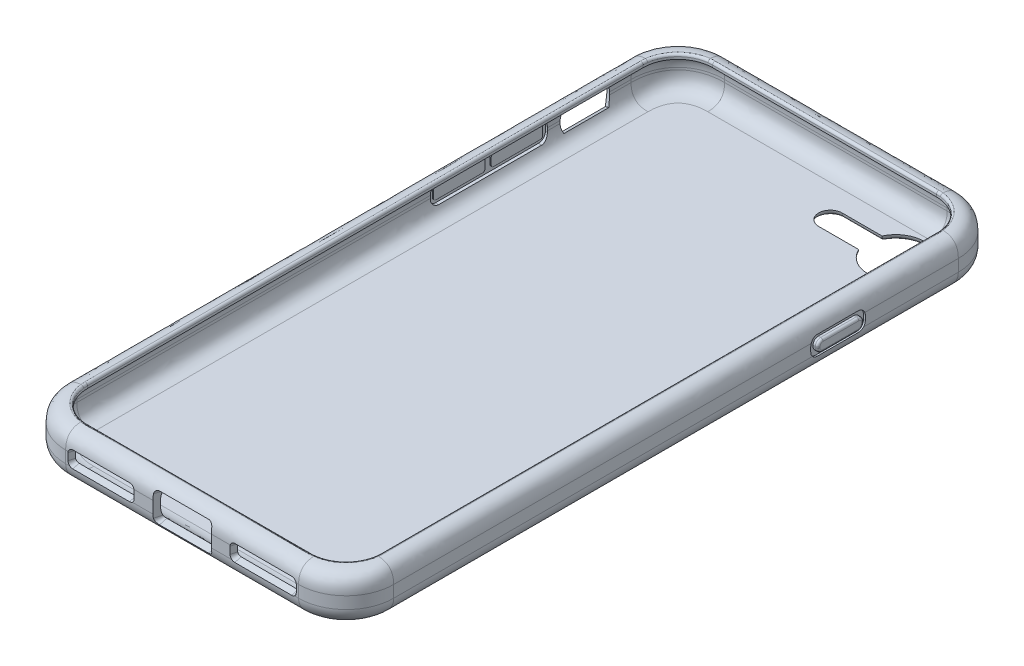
SolidWorks part; units mm, degrees
ref_plane "Front Plane" through (0, 0, 0) normal (0, 0, 1) x (1, 0, 0)
ref_plane "Top Plane" through (0, 0, 0) normal (0, 1, 0) x (1, 0, 0)
ref_plane "Right Plane" through (0, 0, 0) normal (1, 0, 0) x (0, 0, -1)
sketch "Sketch1" plane through (0, 0, 0) normal (0, 1, 0) x (1, 0, 0)
  line L1 (-35.052, 70.5) -> (35.052, 70.5)
  line L2 (-35.052, 70.5) -> (-35.052, -70.5)
  line L3 (-35.052, -70.5) -> (35.052, -70.5)
  line L4 (35.052, 70.5) -> (35.052, -70.5)
  line L5 (-35.052, 70.5) -> (35.052, -70.5) construction
  line L6 (-35.052, -70.5) -> (35.052, 70.5) construction
  point P0 (0, 0)
  dimension "D1" = 70.104
  dimension "D2" = 141
extrude "Back Plane" add sketch "Sketch1" along normal blind 1.27
sketch "Sketch2" plane through (0, 1.27, 0) normal (0, 1, 0) x (1, 0, 0)
  line L0 (-35.052, -70.5) -> (0, -70.5)
  line L1 (-35.052, -70.5) -> (35.052, -70.5) construction
  line L2 (-35.052, 70.5) -> (-35.052, -70.5)
  line L3 (-35.052, 70.5) -> (35.052, 70.5)
  line L4 (-33.782, 69.23) -> (-33.782, -69.23)
  line L5 (0, -70.5) -> (35.052, -70.5)
  line L6 (-33.782, -69.23) -> (33.782, -69.23)
  line L7 (35.052, 70.5) -> (35.052, -70.5)
  line L9 (33.782, 69.23) -> (33.782, -69.23)
  line L12 (-33.782, 69.23) -> (33.782, 69.23)
  dimension "D1" = 1.27
  dimension "D2" = 1.27
  dimension "D3" = 1.27
  dimension "D5" = 1.27
extrude "Sides" add sketch "Sketch2" along normal blind 7.5
sketch "Sketch7" plane through (0, 0, 0) normal (0, -1, 0) x (1, 0, 0)
  line L0 (35.052, 70.5) -> (35.052, -70.5) construction
  line L2 (17.8476, -61.25) -> (9.302, -61.25)
  line L3 (17.8476, -56.25) -> (9.302, -56.25)
  line L6 (35.052, -70.5) -> (-35.052, -70.5) construction
  arc A0 (17.8476, -61.25) -> (17.8476, -56.25) centre (23.302, -58.75) ccw
  arc A2 (9.302, -56.25) -> (9.302, -61.25) centre (9.302, -58.75) ccw
  point P8 (23.302, -58.75)
  dimension "D7" = 12
  dimension "D5" = 2.5
  dimension "D1" = 14
  dimension "D3" = 11.75
  dimension "D4" = 11.75
extrude "Camera Hole" cut sketch "Sketch7" against normal blind 1.27
fillet "Inside Corner Fillet" radius 10 4 edges at (33.782, 5.02, -69.23) (-33.782, 5.02, -69.23) (-33.782, 5.02, 69.23) (33.782, 5.02, 69.23)
fillet "Outside Corner Fillet" radius 10.16 4 edges at (-35.052, 4.385, -70.5) (35.052, 4.385, -70.5) (35.052, 4.385, 70.5) (-35.052, 4.385, 70.5)
fillet "Inside Bottom Fillet" radius 3.6 8 edges
fillet "Outside Bottom Fillet" radius 3.62 8 edges at (-32.0762, 0, 67.5242) (-35.052, 0, 0) (-32.0762, 0, -67.5242) (0, 0, -70.5) (32.0762, 0, -67.5242) (35.052, 0, 0) (32.0762, 0, 67.5242) (0, 0, 70.5)
fillet "Camera Hole FIllet" radius 1.27 4 edges at (29.302, 0, -58.75) (13.5748, 0, -56.25) (6.802, 0, -58.75) (13.5748, 0, -61.25)
sketch "Sketch16" plane through (-35.052, 0, 0) normal (-1, 0, 0) x (0, 0, 1)
  line L0 (-60.34, 8.77) -> (-60.34, 3.62) construction
  line L1 (-54.84, 8.0237) -> (-43.84, 8.0237)
  line L2 (-60.34, 3.62) -> (-60.34, 0) construction
  line L3 (-54.84, 2.0237) -> (-43.84, 2.0237)
  line L6 (-60.34, 3.62) -> (60.34, 3.62) construction
  spline S0 degree 2 poles (-54.84, 8.0237) (-55.867, 5.0522) (-54.84, 2.0237) knots 0 0 0 1 1 1
  spline S1 degree 2 poles (-43.84, 8.0237) (-42.813, 5.0522) (-43.84, 2.0237) knots 0 0 0 1 1 1
  dimension "D1" = 2.5
  dimension "D2" = 6
  dimension "D3" = 1.5963
  dimension "D4" = 1.5963
  dimension "D5" = 2.5
  dimension "D6" = 11
  dimension "D7" = 0.5
  dimension "D8" = 0.5
  dimension "D9" = 5.5
  dimension "D10" = 5.5
  dimension "D11" = 11
extrude "Mute Slider Hole" cut sketch "Sketch16" against normal up to next draft 30
sketch "Sketch18" plane through (-35.052, 0, 0) normal (-1, 0, 0) x (0, 0, 1)
  line L0 (-43.4407, 3.62) -> (60.34, 3.62) construction
  line L1 (-39.8294, 7.12) -> (-17.8294, 7.12)
  line L2 (-41.3294, 5.62) -> (-41.3294, 4.62)
  line L3 (-39.8294, 3.12) -> (-17.8294, 3.12)
  line L4 (-16.3294, 5.62) -> (-16.3294, 4.62)
  arc A0 (-17.8294, 3.12) -> (-16.3294, 4.62) centre (-17.8294, 4.62) ccw
  arc A1 (-17.8294, 7.12) -> (-16.3294, 5.62) centre (-17.8294, 5.62) cw
  arc A2 (-41.3294, 4.62) -> (-39.8294, 3.12) centre (-39.8294, 4.62) ccw
  arc A3 (-39.8294, 7.12) -> (-41.3294, 5.62) centre (-39.8294, 5.62) ccw
  point P12 (-41.3294, 3.12)
  point P15 (-41.3294, 7.12)
  dimension "D3" = 1.5
  dimension "D1" = 4
  dimension "D2" = 0.5
  dimension "D4" = 25
extrude "Volume Rocker Indent" cut sketch "Sketch18" against normal blind 0.4 contours L1 A1 L4 A0 L3 A2 L2 A3
sketch "Sketch19" plane through (-34.652, 0, 0) normal (-1, 0, 0) x (0, 0, 1)
  line L0 (-39.8294, 3.12) -> (-17.8294, 3.12) construction
  line L1 (-39.371, 6.37) -> (-30.621, 6.37)
  line L2 (-40.496, 5.245) -> (-40.496, 4.995)
  line L3 (-39.371, 3.87) -> (-30.621, 3.87)
  line L4 (-29.496, 5.245) -> (-29.496, 4.995)
  line L5 (-27.0377, 6.37) -> (-18.2877, 6.37)
  line L6 (-28.1627, 5.245) -> (-28.1627, 4.995)
  line L7 (-27.0377, 3.87) -> (-18.2877, 3.87)
  line L8 (-17.1627, 5.245) -> (-17.1627, 4.995)
  line L9 (-41.3294, 5.62) -> (-41.3294, 4.62) construction
  arc A0 (-18.2877, 6.37) -> (-17.1627, 5.245) centre (-18.2877, 5.245) cw
  arc A1 (-18.2877, 3.87) -> (-17.1627, 4.995) centre (-18.2877, 4.995) ccw
  arc A2 (-28.1627, 4.995) -> (-27.0377, 3.87) centre (-27.0377, 4.995) ccw
  arc A3 (-27.0377, 6.37) -> (-28.1627, 5.245) centre (-27.0377, 5.245) ccw
  arc A4 (-30.621, 3.87) -> (-29.496, 4.995) centre (-30.621, 4.995) ccw
  arc A5 (-30.621, 6.37) -> (-29.496, 5.245) centre (-30.621, 5.245) cw
  arc A6 (-39.371, 6.37) -> (-40.496, 5.245) centre (-39.371, 5.245) ccw
  arc A7 (-40.496, 4.995) -> (-39.371, 3.87) centre (-39.371, 4.995) ccw
  dimension "D10" = 1.125
  dimension "D1" = 2.5
  dimension "D2" = 0.75
  dimension "D3" = 11
  dimension "D4" = 2.5
  dimension "D5" = 11
  dimension "D6" = 0.75
  dimension "D7" = 0.8333
  dimension "D8" = 0.8333
extrude "Volume Rockers" add sketch "Sketch19" along normal blind 0.9
fillet "Volume Rocker Fillet" radius 0.5 16 edges at (-35.552, 3.87, -34.996) (-35.552, 4.1995, -40.1665) (-35.552, 5.12, -40.496) (-35.552, 6.0405, -40.1665) (-35.552, 6.37, -34.996) (-35.552, 6.0405, -29.8255) (-35.552, 5.12, -29.496) (-35.552, 4.1995, -29.8255) (-35.552, 5.12, -17.1627) (-35.552, 4.1995, -17.4922) (-35.552, 3.87, -22.6627) (-35.552, 4.1995, -27.8332) (-35.552, 5.12, -28.1627) (-35.552, 6.0405, -27.8332) (-35.552, 6.37, -22.6627) (-35.552, 6.0405, -17.4922)
sketch "Sketch20" plane through (35.052, 0, 0) normal (1, 0, 0) x (0, 0, -1)
  line L0 (-60.34, 3.62) -> (60.34, 3.62) construction
  line L1 (38.9591, 7.12) -> (30.2991, 7.12)
  line L2 (40.4591, 5.62) -> (40.4591, 4.62)
  line L3 (38.9591, 3.12) -> (30.2991, 3.12)
  line L4 (28.7991, 5.62) -> (28.7991, 4.62)
  arc A4 (30.2991, 3.12) -> (28.7991, 4.62) centre (30.2991, 4.62) cw
  arc A5 (40.4591, 4.62) -> (38.9591, 3.12) centre (38.9591, 4.62) cw
  arc A6 (38.9591, 7.12) -> (40.4591, 5.62) centre (38.9591, 5.62) cw
  arc A7 (30.2991, 7.12) -> (28.7991, 5.62) centre (30.2991, 5.62) ccw
  point P26 (40.4591, 3.12)
  point P29 (40.4591, 7.12)
  dimension "D5" = 1.5
  dimension "D1" = 0.5
  dimension "D2" = 4
  dimension "D4" = 11.66
extrude "Power Button Indent" cut sketch "Sketch20" against normal blind 0.4
sketch "Sketch23" plane through (34.652, 0, 0) normal (1, 0, 0) x (0, 0, -1)
  line L0 (30.2991, 3.12) -> (38.9591, 3.12) construction
  line L1 (29.6891, 6.37) -> (39.5691, 6.37)
  line L2 (29.6891, 6.37) -> (29.6891, 3.87)
  line L3 (29.6891, 3.87) -> (39.5691, 3.87)
  line L4 (39.5691, 6.37) -> (39.5691, 3.87)
  line L8 (40.4591, 4.62) -> (40.4591, 5.62) construction
  line L9 (28.7991, 5.62) -> (28.7991, 4.62) construction
  point P11 (40.4591, 5.12)
  dimension "D1" = 0.75
  dimension "D3" = 2.5
  dimension "D4" = 0.89
  dimension "D5" = 0.89
extrude "Power Button" add sketch "Sketch23" along normal blind 1 contours L1 L4 L3 L2
fillet "Power Button FIllet 1" radius 1.13 4 edges at (35.152, 6.37, -29.6891) (35.152, 3.87, -29.6891) (35.152, 3.87, -39.5691) (35.152, 6.37, -39.5691)
fillet "Power Button Fillet 2" radius 0.5 8 edges at (35.652, 6.039, -39.2382) (35.652, 5.12, -39.5691) (35.652, 4.201, -39.2382) (35.652, 3.87, -34.6291) (35.652, 4.201, -30.0201) (35.652, 5.12, -29.6891) (35.652, 6.039, -30.0201) (35.652, 6.37, -34.6291)
sketch "Sketch29" plane through (33.782, 0, 0) normal (-1, 0, 0) x (0, 0, 1)
  line L1 (-30.2991, 7.12) -> (-38.9591, 7.12)
  line L2 (-28.7991, 5.62) -> (-28.7991, 4.62)
  line L3 (-30.2991, 3.12) -> (-38.9591, 3.12)
  line L4 (-40.4591, 5.62) -> (-40.4591, 4.62)
  line L5 (-40.4591, 4.62) -> (-40.4591, 5.62) construction
  line L6 (-30.2991, 3.12) -> (-38.9591, 3.12) construction
  arc A4 (-38.9591, 3.12) -> (-40.4591, 4.62) centre (-38.9591, 4.62) cw
  arc A5 (-28.7991, 4.62) -> (-30.2991, 3.12) centre (-30.2991, 4.62) cw
  arc A6 (-30.2991, 7.12) -> (-28.7991, 5.62) centre (-30.2991, 5.62) cw
  arc A7 (-38.9591, 7.12) -> (-40.4591, 5.62) centre (-38.9591, 5.62) ccw
  point P26 (-28.7991, 3.12)
  point P29 (-28.7991, 7.12)
  dimension "D5" = 1.5
  dimension "D1" = 0
  dimension "D2" = 4
  dimension "D3" = 0
  dimension "D4" = 11.66
extrude "Power Button Indent (Inside)" cut sketch "Sketch29" against normal blind 0.4 contours L1 A7 L4 A4 L3 A5 L2 A6
sketch "Sketch32" plane through (34.182, 0, 0) normal (-1, 0, 0) x (0, 0, 1)
  line L0 (-40.4591, 5.62) -> (-40.4591, 4.87) construction
  line L1 (-30.2991, 7.12) -> (-38.9591, 7.12)
  line L2 (-28.7991, 5.62) -> (-28.7991, 4.62)
  line L3 (-30.2991, 3.12) -> (-38.9591, 3.12)
  line L4 (-40.4591, 5.62) -> (-40.4591, 4.62)
  line L7 (-30.2991, 7.12) -> (-38.9591, 7.12) construction
  arc A4 (-38.9591, 3.12) -> (-40.4591, 4.62) centre (-38.9591, 4.62) cw
  arc A5 (-28.7991, 4.62) -> (-30.2991, 3.12) centre (-30.2991, 4.62) cw
  arc A6 (-30.2991, 7.12) -> (-28.7991, 5.62) centre (-30.2991, 5.62) cw
  arc A7 (-38.9591, 7.12) -> (-40.4591, 5.62) centre (-38.9591, 5.62) ccw
  point P26 (-28.7991, 3.12)
  point P29 (-28.7991, 7.12)
  dimension "D5" = 1.5
  dimension "D1" = 0
  dimension "D2" = 4
  dimension "D3" = 0
  dimension "D4" = 11.66
extrude "Power Button Indent (Inside) 2" cut sketch "Sketch32" along normal blind 5 contours L4 A4 L3 A5 L2 A6 L1 A7
sketch "Sketch35" plane through (34.182, 0, 0) normal (-1, 0, 0) x (0, 0, 1)
  line L1 (-38.4391, 6.37) -> (-30.8191, 6.37)
  line L2 (-39.5691, 5.24) -> (-39.5691, 5)
  line L3 (-38.4391, 3.87) -> (-30.8191, 3.87)
  line L4 (-29.6891, 5.24) -> (-29.6891, 5)
  line L5 (-40.4591, 5.62) -> (-40.4591, 4.62) construction
  line L6 (-28.7991, 5.62) -> (-28.7991, 4.62) construction
  line L10 (-30.2991, 3.12) -> (-38.9591, 3.12) construction
  line L11 (-30.2991, 7.12) -> (-38.9591, 7.12) construction
  arc A0 (-30.8191, 3.87) -> (-29.6891, 5) centre (-30.8191, 5) ccw
  arc A1 (-30.8191, 6.37) -> (-29.6891, 5.24) centre (-30.8191, 5.24) cw
  arc A2 (-39.5691, 5) -> (-38.4391, 3.87) centre (-38.4391, 5) ccw
  arc A3 (-38.4391, 6.37) -> (-39.5691, 5.24) centre (-38.4391, 5.24) ccw
  dimension "D6" = 1.13
  dimension "D1" = 0.89
  dimension "D2" = 0.89
  dimension "D3" = 2.5
  dimension "D4" = 0.75
  dimension "D5" = 0.75
extrude "Power Button Nub (Inside)" add sketch "Sketch35" along normal blind 0.25
sketch "Sketch36" plane through (-33.782, 0, 0) normal (1, 0, 0) x (0, 0, -1)
  line L1 (17.8294, 7.12) -> (39.8294, 7.12)
  line L2 (16.3294, 5.62) -> (16.3294, 4.62)
  line L3 (17.8294, 3.12) -> (39.8294, 3.12)
  line L4 (41.3294, 5.62) -> (41.3294, 4.62)
  line L5 (12.3294, 6.8267) -> (11.0942, 3.9367) construction
  line L6 (16.3294, 5.62) -> (16.3294, 4.62) construction
  line L7 (39.8294, 3.12) -> (17.8294, 3.12) construction
  arc A0 (39.8294, 3.12) -> (41.3294, 4.62) centre (39.8294, 4.62) ccw
  arc A1 (39.8294, 7.12) -> (41.3294, 5.62) centre (39.8294, 5.62) cw
  arc A2 (16.3294, 4.62) -> (17.8294, 3.12) centre (17.8294, 4.62) ccw
  arc A3 (17.8294, 7.12) -> (16.3294, 5.62) centre (17.8294, 5.62) ccw
  point P4 (16.3294, 5.12)
  point P12 (16.3294, 3.12)
  point P15 (16.3294, 7.12)
  point P20 (11.0942, 3.9367)
  point P21 (12.3294, 6.8267)
  dimension "D3" = 1.5
  dimension "D5" = 0
  dimension "D1" = 4
  dimension "D2" = 0
  dimension "D4" = 25
  dimension "D6" = 4
extrude "Volume Rocker Indent (Inside)" cut sketch "Sketch36" against normal blind 0.4
sketch "Sketch37" plane through (-34.182, 0, 0) normal (1, 0, 0) x (0, 0, -1)
  line L1 (17.8294, 7.12) -> (39.8294, 7.12)
  line L2 (16.3294, 5.62) -> (16.3294, 4.62)
  line L3 (17.8294, 3.12) -> (39.8294, 3.12)
  line L4 (41.3294, 5.62) -> (41.3294, 4.62)
  line L5 (12.3294, 6.6598) -> (11.0942, 3.7698) construction
  line L6 (16.3294, 5.62) -> (16.3294, 4.87) construction
  line L7 (39.8294, 7.12) -> (17.8294, 7.12) construction
  arc A0 (39.8294, 3.12) -> (41.3294, 4.62) centre (39.8294, 4.62) ccw
  arc A1 (39.8294, 7.12) -> (41.3294, 5.62) centre (39.8294, 5.62) cw
  arc A2 (16.3294, 4.62) -> (17.8294, 3.12) centre (17.8294, 4.62) ccw
  arc A3 (17.8294, 7.12) -> (16.3294, 5.62) centre (17.8294, 5.62) ccw
  point P12 (16.3294, 3.12)
  point P15 (16.3294, 7.12)
  point P20 (11.0942, 3.7698)
  point P21 (12.3294, 6.6598)
  dimension "D3" = 1.5
  dimension "D5" = 0
  dimension "D1" = 4
  dimension "D2" = 0
  dimension "D4" = 25
  dimension "D6" = 4
extrude "Volume Rocker Indent (Inside) 2" cut sketch "Sketch37" along normal blind 5
sketch "Sketch42" plane through (-34.182, 0, 0) normal (1, 0, 0) x (0, 0, -1)
  line L1 (27.6627, 6.37) -> (17.6627, 6.37)
  line L2 (28.1627, 5.87) -> (28.1627, 4.37)
  line L3 (27.6627, 3.87) -> (17.6627, 3.87)
  line L4 (17.1627, 5.87) -> (17.1627, 4.37)
  line L5 (29.996, 6.37) -> (39.996, 6.37)
  line L6 (29.496, 5.87) -> (29.496, 4.37)
  line L7 (29.996, 3.87) -> (39.996, 3.87)
  line L8 (40.496, 5.87) -> (40.496, 4.37)
  arc A0 (39.996, 6.37) -> (40.496, 5.87) centre (39.996, 5.87) cw
  arc A1 (39.996, 3.87) -> (40.496, 4.37) centre (39.996, 4.37) ccw
  arc A2 (29.496, 4.37) -> (29.996, 3.87) centre (29.996, 4.37) ccw
  arc A3 (29.996, 6.37) -> (29.496, 5.87) centre (29.996, 5.87) ccw
  arc A4 (17.6627, 6.37) -> (17.1627, 5.87) centre (17.6627, 5.87) ccw
  arc A5 (17.6627, 3.87) -> (17.1627, 4.37) centre (17.6627, 4.37) cw
  arc A6 (28.1627, 4.37) -> (27.6627, 3.87) centre (27.6627, 4.37) cw
  arc A7 (27.6627, 6.37) -> (28.1627, 5.87) centre (27.6627, 5.87) cw
  dimension "D9" = 0.5
  dimension "D1" = 0
  dimension "D2" = 0
  dimension "D3" = 0
  dimension "D4" = 0
  dimension "D5" = 0
  dimension "D6" = 0
  dimension "D7" = 0
  dimension "D8" = 0
extrude "Volume Rocker Nub (Inside)" add sketch "Sketch42" along normal blind 0.25
sketch "Sketch43" plane through (0, 8.77, 0) normal (0, 1, 0) x (1, 0, 0)
  line L0 (35.052, -60.34) -> (35.052, 60.34) construction
  line L1 (-24.892, 70.5) -> (24.892, 70.5)
  line L2 (-35.052, 60.34) -> (-35.052, -60.34)
  line L3 (-24.892, -70.5) -> (24.892, -70.5)
  line L4 (35.052, 60.34) -> (35.052, -60.34)
  line L5 (-24.892, -70.5) -> (24.892, -70.5) construction
  line L6 (-35.052, 60.34) -> (-35.052, -60.34) construction
  line L7 (24.892, 70.5) -> (-24.892, 70.5) construction
  line L9 (-23.922, 66.8) -> (23.922, 66.8)
  line L10 (-31.352, 59.37) -> (-31.352, -59.37)
  line L11 (-23.922, -66.8) -> (23.922, -66.8)
  line L12 (31.352, 59.37) -> (31.352, -59.37)
  arc A0 (-24.892, 70.5) -> (-35.052, 60.34) centre (-24.892, 60.34) ccw
  arc A1 (24.892, 70.5) -> (35.052, 60.34) centre (24.892, 60.34) cw
  arc A2 (24.892, -70.5) -> (35.052, -60.34) centre (24.892, -60.34) ccw
  arc A3 (-35.052, -60.34) -> (-24.892, -70.5) centre (-24.892, -60.34) ccw
  arc A4 (23.922, 66.8) -> (31.352, 59.37) centre (23.922, 59.37) cw
  arc A5 (-23.922, 66.8) -> (-31.352, 59.37) centre (-23.922, 59.37) ccw
  arc A6 (-31.352, -59.37) -> (-23.922, -66.8) centre (-23.922, -59.37) ccw
  arc A7 (23.922, -66.8) -> (31.352, -59.37) centre (23.922, -59.37) ccw
  dimension "D1" = 10.16
  dimension "D6" = 7.43
  dimension "D2" = 3.7
  dimension "D3" = 3.7
  dimension "D4" = 3.7
  dimension "D5" = 3.7
extrude "Lip" add sketch "Sketch43" along normal blind 1
fillet "Top Outside Fillet" radius 3.6 8 edges at (-32.0762, 9.77, -67.5242) (0, 9.77, -70.5) (32.0762, 9.77, -67.5242) (35.052, 9.77, 0) (32.0762, 9.77, 67.5242) (0, 9.77, 70.5) (-32.0762, 9.77, 67.5242) (-35.052, 9.77, 0)
fillet "Top Inside Fillet" radius 3.5 8 edges
fillet "Lip Fillet" radius 0.5 8 edges at (-29.1758, 9.77, -64.6238) (0, 9.77, -66.8) (29.1758, 9.77, -64.6238) (31.352, 9.77, 0) (29.1758, 9.77, 64.6238) (0, 9.77, 66.8) (-29.1758, 9.77, 64.6238) (-31.352, 9.77, 0)
sketch "Sketch40" plane through (0, 0, 70.5) normal (0, 0, 1) x (1, 0, 0)
  line L1 (0, 8.32) -> (0, 1.82) construction
  line L2 (-24.892, 3.62) -> (24.892, 3.62) construction
  line L3 (24.892, 3.62) -> (24.892, 6.17) construction
  line L4 (-24.392, 5.9172) -> (-24.392, 4.4172)
  line L5 (11.25, 6.9172) -> (23.392, 6.9172)
  line L6 (-24.892, 6.17) -> (-24.892, 3.62) construction
  line L7 (5.25, 8.32) -> (-5.25, 8.32)
  line L8 (6.25, 7.32) -> (6.25, 2.82)
  line L9 (5.25, 1.82) -> (-5.25, 1.82)
  line L10 (-6.25, 7.32) -> (-6.25, 2.82)
  line L11 (10.25, 5.9172) -> (10.25, 4.4172)
  line L12 (11.25, 3.4172) -> (23.392, 3.4172)
  line L13 (24.392, 5.9172) -> (24.392, 4.4172)
  line L14 (-11.25, 3.4172) -> (-23.392, 3.4172)
  line L15 (-10.25, 5.9172) -> (-10.25, 4.4172)
  line L16 (-11.25, 6.9172) -> (-23.392, 6.9172)
  arc A0 (-23.392, 6.9172) -> (-24.392, 5.9172) centre (-23.392, 5.9172) ccw
  arc A1 (-5.25, 8.32) -> (-6.25, 7.32) centre (-5.25, 7.32) ccw
  arc A2 (-5.25, 1.82) -> (-6.25, 2.82) centre (-5.25, 2.82) cw
  arc A3 (6.25, 2.82) -> (5.25, 1.82) centre (5.25, 2.82) cw
  arc A4 (5.25, 8.32) -> (6.25, 7.32) centre (5.25, 7.32) cw
  arc A5 (10.25, 4.4172) -> (11.25, 3.4172) centre (11.25, 4.4172) ccw
  arc A6 (23.392, 3.4172) -> (24.392, 4.4172) centre (23.392, 4.4172) ccw
  arc A7 (23.392, 6.9172) -> (24.392, 5.9172) centre (23.392, 5.9172) cw
  arc A8 (11.25, 6.9172) -> (10.25, 5.9172) centre (11.25, 5.9172) ccw
  arc A9 (-23.392, 3.4172) -> (-24.392, 4.4172) centre (-23.392, 4.4172) cw
  arc A10 (-10.25, 4.4172) -> (-11.25, 3.4172) centre (-11.25, 4.4172) cw
  arc A11 (-11.25, 6.9172) -> (-10.25, 5.9172) centre (-11.25, 5.9172) cw
  point P18 (-6.25, 8.32)
  point P21 (-6.25, 1.82)
  dimension "D3" = 1.5
  dimension "D11" = 1
  dimension "D16" = 1
  dimension "D5" = 18.642
  dimension "D6" = 6.5
  dimension "D7" = 1.8
  dimension "D8" = 1.8
  dimension "D9" = 12.5
  dimension "D10" = 18.642
  dimension "D12" = 4
  dimension "D13" = 0.5
extrude "Cut-Extrude20" cut sketch "Sketch40" against normal up to next draft 15
equation "\"``.75\"=12.5"
